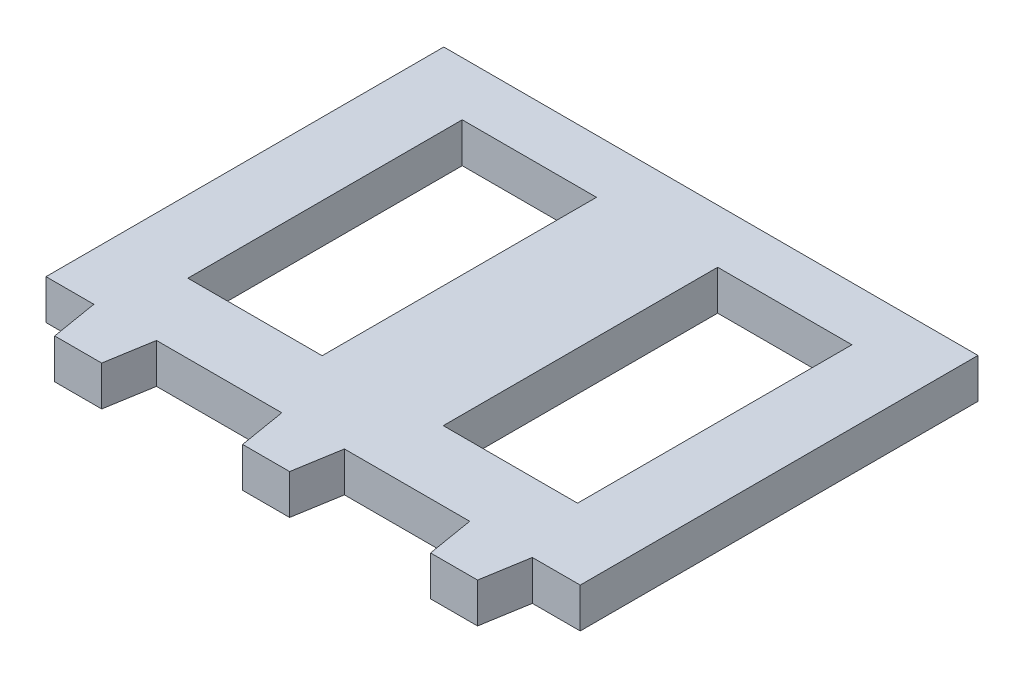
SolidWorks part; units mm, degrees
ref_plane "Front Plane" through (0, 0, 0) normal (0, 0, 1) x (1, 0, 0)
ref_plane "Top Plane" through (0, 0, 0) normal (0, 1, 0) x (1, 0, 0)
ref_plane "Right Plane" through (0, 0, 0) normal (1, 0, 0) x (0, 0, -1)
sketch "Sketch2" plane through (0, 0, 0) normal (0, 1, 0) x (1, 0, 0)
  line L0 (0, 0) -> (0, -127889.9036) construction
  line L1 (-42.6398, 31.75) -> (42.6398, 31.75)
  line L2 (-42.6398, 31.75) -> (-42.6398, -31.75)
  line L3 (-42.6398, -31.75) -> (42.6398, -31.75)
  line L4 (42.6398, 31.75) -> (42.6398, -31.75)
  line L5 (-42.6398, 31.75) -> (42.6398, -31.75) construction
  line L6 (-42.6398, -31.75) -> (42.6398, 31.75) construction
  line L7 (-5, -31.75) -> (5, -31.75)
  line L8 (5, -31.75) -> (3.75, -39.25)
  line L9 (3.75, -39.25) -> (-3.75, -39.25)
  line L10 (-3.75, -39.25) -> (-5, -31.75)
  line L11 (0, -31.75) -> (0, -96.5171) construction
  line L12 (-35, -31.75) -> (-25, -31.75)
  line L13 (-25, -31.75) -> (-26.25, -39.25)
  line L14 (-26.25, -39.25) -> (-33.75, -39.25)
  line L15 (-33.75, -39.25) -> (-35, -31.75)
  line L16 (-30, -31.75) -> (-30, -95.4613) construction
  line L21 (-60, -31.75) -> (-60, -90.4367) construction
  line L22 (60, -31.75) -> (60, -90.4367) construction
  line L23 (30, -31.75) -> (30, -95.4613) construction
  line L28 (33.75, -39.25) -> (35, -31.75)
  line L29 (26.25, -39.25) -> (33.75, -39.25)
  line L30 (25, -31.75) -> (26.25, -39.25)
  line L31 (35, -31.75) -> (25, -31.75)
  line L32 (31.1021, -20.6396) -> (9.6697, -20.6396)
  line L33 (-31.1021, 23.1589) -> (-9.6697, 23.1589)
  line L34 (-31.1021, 23.1589) -> (-31.1021, -20.6396)
  line L35 (-31.1021, -20.6396) -> (-9.6697, -20.6396)
  line L36 (-9.6697, 23.1589) -> (-9.6697, -20.6396)
  line L37 (9.6697, 23.1589) -> (9.6697, -20.6396)
  line L38 (31.1021, 23.1589) -> (9.6697, 23.1589)
  line L39 (31.1021, 23.1589) -> (31.1021, -20.6396)
  point P0 (0, 0)
  point P46 (-55, 40.9535)
  point P47 (-31.1021, -14.2122)
extrude "Boss-Extrude1" add sketch "Sketch2" along normal blind 6.35
equation "\"toothBaseWidth\"=0.01"
equation "\"toothEndWidth\"=0.0075"
equation "\"toothLength\"=0.0075"
equation "\"D2@Sketch2\"= \"toothEndWidth\""
equation "\"D3@Sketch2\"= \"toothLength\""
equation "\"holeWidth\" = 0.009"
equation "\"motorHolderToothSeparation\" = 0.01"
equation "\"magnetHolderToothSeparation\" = 0.02"
equation "\"D13@Sketch2\"= \"magnetHolderToothSeparation\""
